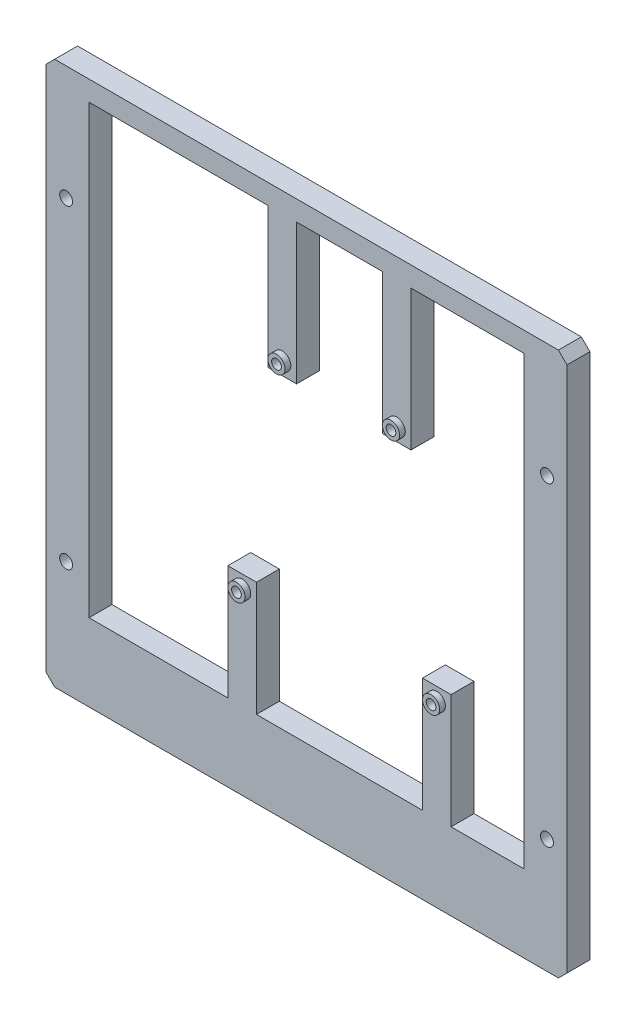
SolidWorks part; units mm, degrees
ref_plane "前视基准面" through (0, 0, 0) normal (0, 0, 1) x (1, 0, 0)
ref_plane "上视基准面" through (0, 0, 0) normal (0, 1, 0) x (1, 0, 0)
ref_plane "右视基准面" through (0, 0, 0) normal (1, 0, 0) x (0, 0, -1)
other "Configuration Table"
sketch "草图1" plane through (0, 0, 0) normal (0, 0, 1) x (1, 0, 0)
  line L0 (-98, -95) -> (78, -95)
  line L1 (78, -95) -> (81, -92)
  line L2 (81, -92) -> (81, 92)
  line L3 (81, 92) -> (78, 95)
  line L4 (78, 95) -> (-98, 95)
  line L5 (-98, 95) -> (-101, 92)
  line L6 (-101, 92) -> (-101, -92)
  line L7 (-101, -92) -> (-98, -95)
  line L8 (-86, -68) -> (66, -68)
  line L9 (66, -68) -> (66, 88)
  line L10 (66, 88) -> (-86, 88)
  line L11 (-86, 88) -> (-86, -68)
  circle A0 centre (-94, -55) radius 2.25
  circle A1 centre (-94, 55) radius 2.25
  circle A2 centre (74, -55) radius 2.25
  circle A3 centre (74, 55) radius 2.25
  dimension "D1" = 4.5
  dimension "D2" = 66
  dimension "D3" = 74
  dimension "D4" = 78
  dimension "D5" = 81
  dimension "D6" = 86
  dimension "D7" = 94
  dimension "D8" = 98
  dimension "D9" = 55
  dimension "D10" = 88
  dimension "D11" = 92
  dimension "D12" = 95
  dimension "D13" = 55
  dimension "D14" = 68
  dimension "D15" = 92
extrude "Common_open_frame_M4_holes" add sketch "草图1" along normal blind 8
sketch "草图2" plane through (0, 0, 0) normal (0, 0, 1) x (1, 0, 0)
  line L0 (-37.5, -92) -> (-27.5, -92)
  line L1 (-27.5, -92) -> (-27.5, -28)
  line L2 (-27.5, -28) -> (-37.5, -28)
  line L3 (-37.5, -28) -> (-37.5, -92)
  circle A0 centre (-32.5, -32.5) radius 1.7
  dimension "D1" = 3.4
  dimension "D2" = 27.5
  dimension "D3" = 32.5
  dimension "D4" = 37.5
  dimension "D5" = 28
  dimension "D6" = 32.5
  dimension "D7" = 92
extrude "Joined_PCB_mount_tab_1" add sketch "草图2" along normal blind 8
sketch "草图3" plane through (0, 0, 0) normal (0, 0, 1) x (1, 0, 0)
  line L0 (30.5, -92) -> (40.5, -92)
  line L1 (40.5, -92) -> (40.5, -28)
  line L2 (40.5, -28) -> (30.5, -28)
  line L3 (30.5, -28) -> (30.5, -92)
  circle A0 centre (35.5, -32.5) radius 1.7
  dimension "D1" = 3.4
  dimension "D2" = 30.5
  dimension "D3" = 35.5
  dimension "D4" = 40.5
  dimension "D5" = 28
  dimension "D6" = 32.5
  dimension "D7" = 92
extrude "Joined_PCB_mount_tab_2" add sketch "草图3" along normal blind 8
sketch "草图4" plane through (0, 0, 0) normal (0, 0, 1) x (1, 0, 0)
  line L0 (16.5, 39) -> (26.5, 39)
  line L1 (26.5, 39) -> (26.5, 92)
  line L2 (26.5, 92) -> (16.5, 92)
  line L3 (16.5, 92) -> (16.5, 39)
  circle A0 centre (21.5, 43.5) radius 1.7
  dimension "D1" = 3.4
  dimension "D2" = 16.5
  dimension "D3" = 21.5
  dimension "D4" = 26.5
  dimension "D5" = 39
  dimension "D6" = 43.5
  dimension "D7" = 92
extrude "Joined_PCB_mount_tab_3" add sketch "草图4" along normal blind 8
sketch "草图5" plane through (0, 0, 0) normal (0, 0, 1) x (1, 0, 0)
  line L0 (-23.5, 39) -> (-13.5, 39)
  line L1 (-13.5, 39) -> (-13.5, 92)
  line L2 (-13.5, 92) -> (-23.5, 92)
  line L3 (-23.5, 92) -> (-23.5, 39)
  circle A0 centre (-18.5, 43.5) radius 1.7
  dimension "D1" = 3.4
  dimension "D2" = 13.5
  dimension "D3" = 18.5
  dimension "D4" = 23.5
  dimension "D5" = 39
  dimension "D6" = 43.5
  dimension "D7" = 92
extrude "Joined_PCB_mount_tab_4" add sketch "草图5" along normal blind 8
sketch "草图6" plane through (0, 0, 0) normal (0, 0, 1) x (1, 0, 0)
  circle A0 centre (-32.5, -32.5) radius 3
  circle A1 centre (-32.5, -32.5) radius 1.7
  circle A2 centre (35.5, -32.5) radius 3
  circle A3 centre (35.5, -32.5) radius 1.7
  circle A4 centre (21.5, 43.5) radius 3
  circle A5 centre (21.5, 43.5) radius 1.7
  circle A6 centre (-18.5, 43.5) radius 3
  circle A7 centre (-18.5, 43.5) radius 1.7
  dimension "D1" = 3.4
  dimension "D2" = 6
  dimension "D3" = 21.5
  dimension "D4" = 35.5
  dimension "D5" = 18.5
  dimension "D6" = 32.5
  dimension "D7" = 43.5
  dimension "D8" = 32.5
extrude "Four_front_contact_bosses_OD6" add sketch "草图6" along normal blind 2 from offset 8
